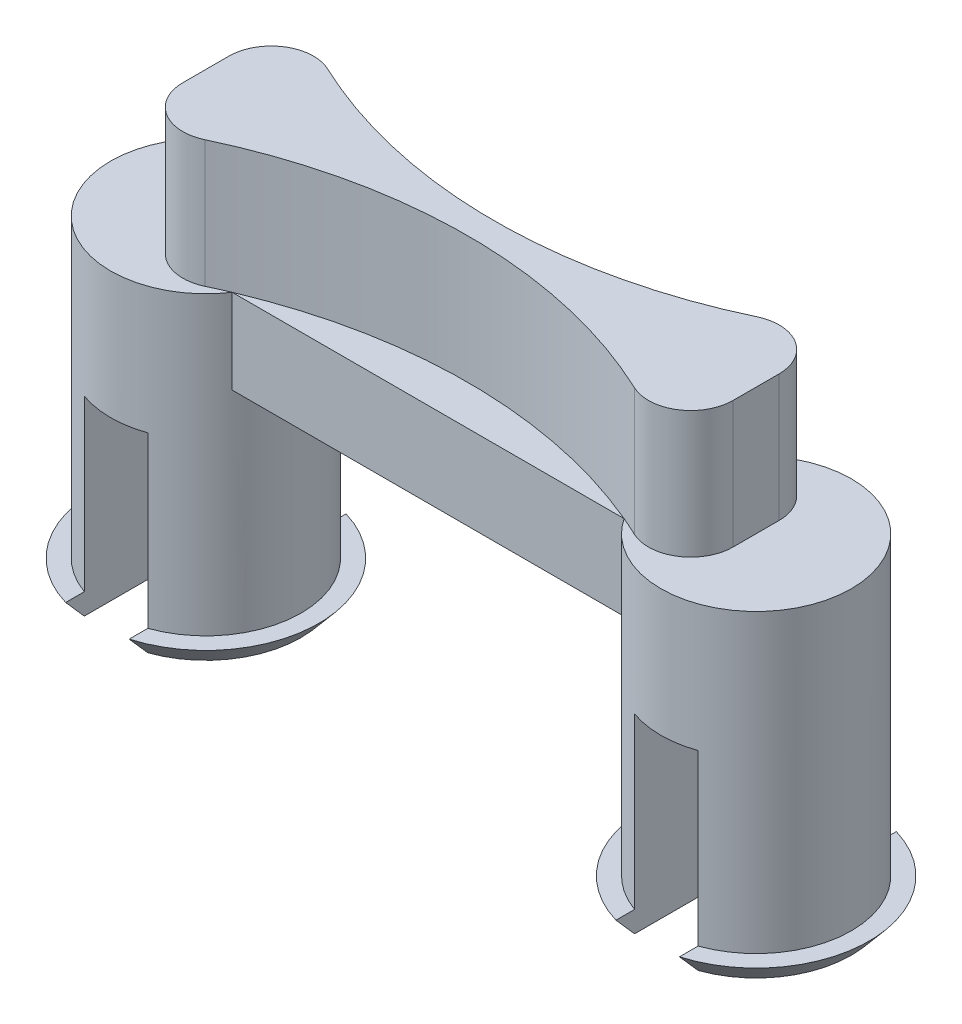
SolidWorks part; units mm, degrees
ref_plane "Front Plane" through (0, 0, 0) normal (0, 0, 1) x (1, 0, 0)
ref_plane "Top Plane" through (0, 0, 0) normal (0, 1, 0) x (1, 0, 0)
ref_plane "Right Plane" through (0, 0, 0) normal (1, 0, 0) x (0, 0, -1)
sketch "Sketch1" plane through (0, 0, 0) normal (0, 1, 0) x (1, 0, 0)
  circle A0 centre (0, 0) radius 2.8575
  circle A1 centre (16.51, 0) radius 2.8575
  point P5 (0, 0)
  dimension "D1" = 5.715
  dimension "D2" = 16.51
extrude "Boss-Extrude1" add sketch "Sketch1" along normal blind 9.525
sketch "Sketch2" plane through (0, 9.525, 0) normal (0, 1, 0) x (1, 0, 0)
  line L0 (2.376, 1.5875) -> (14.134, 1.5875)
  line L1 (14.134, 1.5875) -> (14.134, -1.5875)
  line L2 (14.134, -1.5875) -> (2.376, -1.5875)
  line L3 (2.376, -1.5875) -> (2.376, 1.5875)
  circle A2 centre (0, 0) radius 2.8575 construction
  circle A4 centre (16.51, 0) radius 2.8575 construction
  point P2 (0, 0)
  point P5 (0, 0)
  point P6 (1.8584, -1.7314)
  point P10 (0, 0)
  point P11 (0, 0)
  point P13 (0, 0)
  point P14 (14.6828, -1.5875)
  dimension "D1" = 3.175
extrude "Boss-Extrude2" add sketch "Sketch2" against normal blind 2.54
sketch "Sketch3" plane through (0, 0, 0) normal (0, -1, 0) x (1, 0, 0)
  circle A0 centre (0, 0) radius 2.8575
  circle A1 centre (16.51, 0) radius 2.8575
  circle A2 centre (0, 0) radius 2.8575 construction
  circle A3 centre (16.51, 0) radius 2.8575 construction
extrude "Boss-Extrude3" add sketch "Sketch3" against normal blind 0.635 draft 40
sketch "Sketch4" plane through (0, 0, 0) normal (0, -1, 0) x (1, 0, 0)
  line L1 (0.9525, -5.08) -> (-0.9525, -5.08)
  line L2 (0.9525, -5.08) -> (0.9525, 5.08)
  line L3 (0.9525, 5.08) -> (-0.9525, 5.08)
  line L4 (-0.9525, -5.08) -> (-0.9525, 5.08)
  line L5 (0.9525, -5.08) -> (-0.9525, 5.08) construction
  line L6 (0.9525, 5.08) -> (-0.9525, -5.08) construction
  line L7 (17.4625, -5.08) -> (15.5575, -5.08)
  line L8 (17.4625, -5.08) -> (17.4625, 5.08)
  line L9 (17.4625, 5.08) -> (15.5575, 5.08)
  line L10 (15.5575, -5.08) -> (15.5575, 5.08)
  line L11 (17.4625, -5.08) -> (15.5575, 5.08) construction
  line L12 (17.4625, 5.08) -> (15.5575, -5.08) construction
  point P0 (0, 0)
  point P6 (16.51, 0)
  dimension "D1" = 1.905
  dimension "D2" = 10.16
extrude "Cut-Extrude1" cut sketch "Sketch4" against normal blind 5.715
sketch "Sketch6" plane through (0, 9.525, 0) normal (0, 1, 0) x (1, 0, 0)
  line L0 (0, -2.8575) -> (0, 2.8575)
  line L1 (16.51, -2.8575) -> (16.51, 2.8575)
  arc A0 (2.376, 1.5875) -> (2.376, -1.5875) centre (0, 0) ccw construction
  arc A1 (14.134, -1.5875) -> (14.134, 1.5875) centre (16.51, 0) ccw construction
  arc A2 (16.51, -2.8575) -> (0, -2.8575) centre (8.255, -15.4437) ccw
  arc A3 (0, 2.8575) -> (16.51, 2.8575) centre (8.255, 15.4437) ccw
extrude "Boss-Extrude4" add sketch "Sketch6" along normal blind 3.81
fillet "Fillet1" radius 1.27 4 edges at (0, 11.43, 2.8575) (0, 11.43, -2.8575) (16.51, 11.43, 2.8575) (16.51, 11.43, -2.8575)
